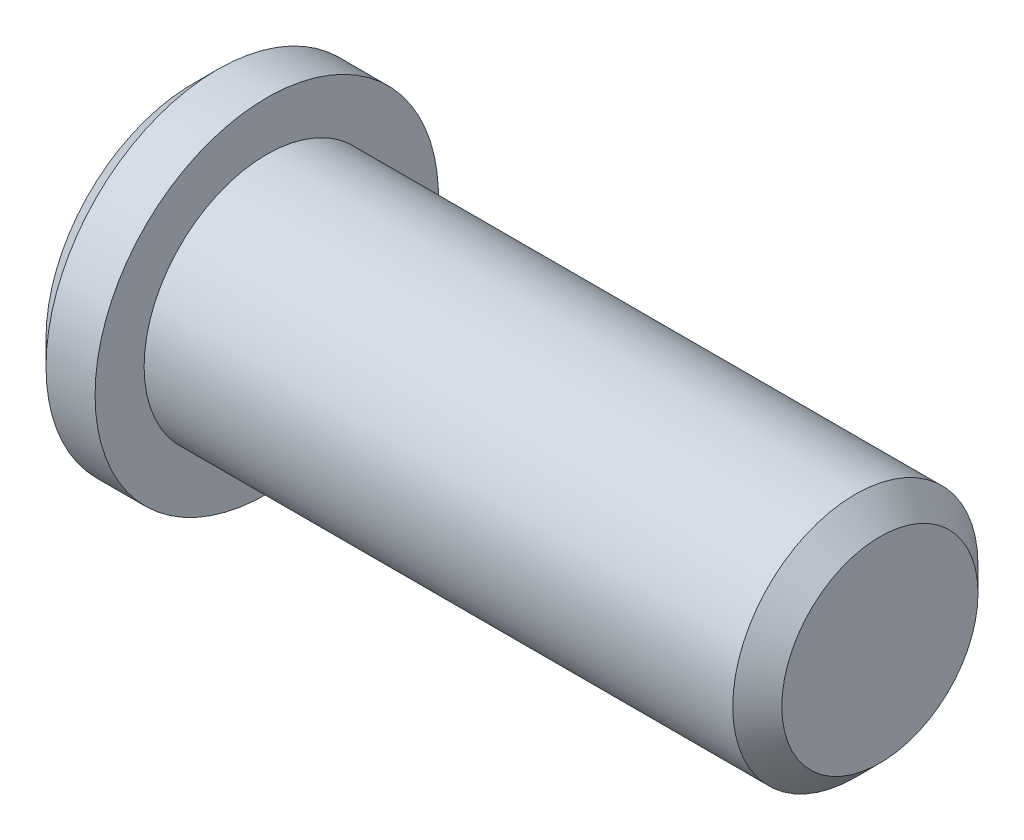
SolidWorks part; units mm, degrees
ref_plane "前视基准面" through (0, 0, 0) normal (0, 0, 1) x (1, 0, 0)
ref_plane "上视基准面" through (0, 0, 0) normal (0, 1, 0) x (1, 0, 0)
ref_plane "右视基准面" through (0, 0, 0) normal (1, 0, 0) x (0, 0, -1)
sketch "草图1" plane through (0, 0, 0) normal (0, 0, 1) x (1, 0, 0)
  line L0 (-84.2309, 0) -> (81.9897, 0) construction
  line L1 (-37.1544, 5) -> (-12.1544, 5)
  line L2 (-12.1544, 5) -> (-12.1544, 0)
  line L3 (-37.1544, 5) -> (-37.1544, 7)
  line L4 (-37.1544, 7) -> (-40.1544, 7)
  line L5 (-40.1544, 7) -> (-40.1544, 0)
  line L6 (-12.1544, 0) -> (-40.1544, 0)
  dimension "D1" = 7
  dimension "D2" = 3
  dimension "D3" = 25
  dimension "D4" = 2
revolve "旋转1" add sketch "草图1" angle 360 about L0
chamfer "倒角1" distance 1 angle 45 2 edges at (-12.1544, 0, 5) (-40.1544, 0, 7)
